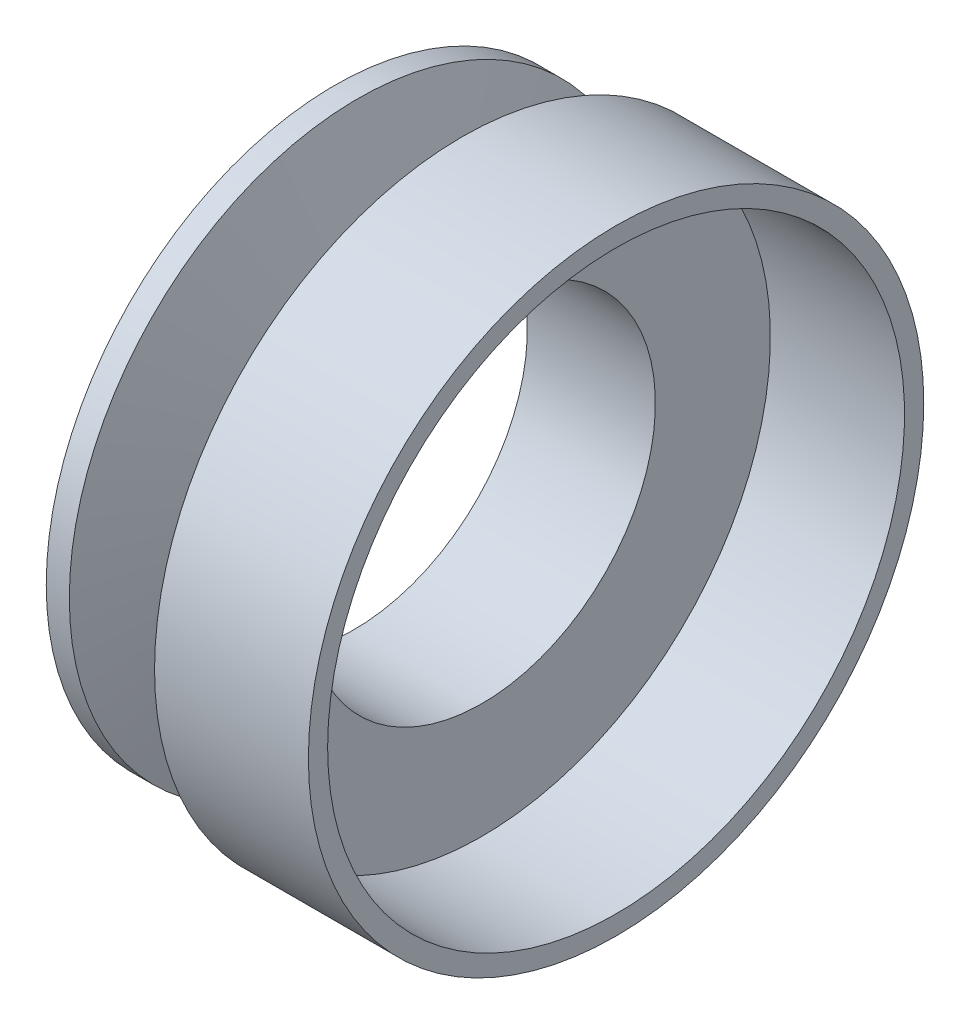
SolidWorks part; units mm, degrees
ref_plane "Plan de face" through (0, 0, 0) normal (0, 0, 1) x (1, 0, 0)
ref_plane "Plan de dessus" through (0, 0, 0) normal (0, 1, 0) x (1, 0, 0)
ref_plane "Plan de droite" through (0, 0, 0) normal (1, 0, 0) x (0, 0, -1)
sketch "Esquisse2" plane through (0, 0, 0) normal (0, 0, 1) x (1, 0, 0)
  line L0 (0, 0) -> (93.8406, 0) construction
  line L1 (0, 26.15) -> (0, 37.5)
  line L2 (0, 37.5) -> (3, 37.5)
  line L3 (3, 37.5) -> (6.58, 24.15)
  line L4 (6.58, 24.15) -> (16.58, 24.15)
  line L5 (0, 26.15) -> (2.5, 26.15)
  line L6 (2.5, 26.15) -> (2.5, 22.55)
  line L7 (2.5, 22.55) -> (19.14, 22.55)
  line L8 (16.58, 24.15) -> (16.58, 40)
  line L9 (16.58, 40) -> (36.58, 40)
  line L10 (36.58, 40) -> (36.58, 37.5)
  line L11 (36.58, 37.5) -> (19.14, 37.5)
  line L12 (19.14, 37.5) -> (19.14, 22.55)
  dimension "D1" = 75
  dimension "D2" = 3
  dimension "D3" = 3.58
  dimension "D4" = 48.3
  dimension "D5" = 52.3
  dimension "D6" = 2.5
  dimension "D7" = 45.1
  dimension "D8" = 80
  dimension "D9" = 10
  dimension "D10" = 20
  dimension "D11" = 2.56
  dimension "D12" = 2.5
revolve "Révolution1" add sketch "Esquisse2" angle 360 about L0
